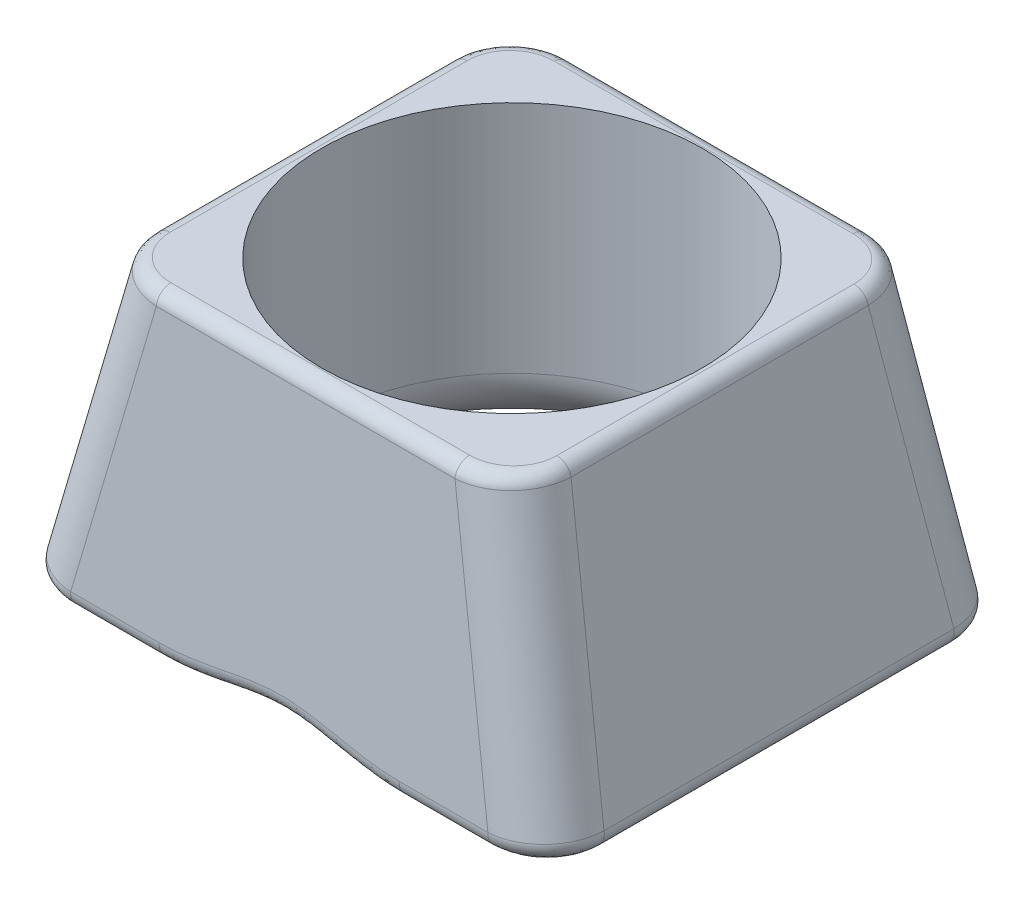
SolidWorks part; units mm, degrees
ref_plane "Front Plane" through (0, 0, 0) normal (0, 0, 1) x (1, 0, 0)
ref_plane "Top Plane" through (0, 0, 0) normal (0, 1, 0) x (1, 0, 0)
ref_plane "Right Plane" through (0, 0, 0) normal (1, 0, 0) x (0, 0, -1)
sketch "Sketch2" plane through (0, 0, 0) normal (0, 1, 0) x (1, 0, 0)
  line L1 (-58.7248, -50.8) -> (58.7502, -50.8)
  line L2 (-58.7248, -50.8) -> (-58.7248, 50.8)
  line L3 (-58.7248, 50.8) -> (58.7502, 50.8)
  line L4 (58.7502, -50.8) -> (58.7502, 50.8)
  dimension "D1" = 117.475
  dimension "D2" = 58.7248
  dimension "D3" = 101.6
  dimension "D4" = 50.8
extrude "Boss-Extrude1" add sketch "Sketch2" against normal blind 63.5
sketch "Sketch3" plane through (0, 0, 50.8) normal (0, 0, 1) x (1, 0, 0)
  line L0 (-58.7248, -63.5) -> (-44.45, 0)
  line L1 (-58.7248, 0) -> (58.7502, 0) construction
  line L2 (-58.7248, -63.5) -> (-58.7248, 0) construction
  dimension "D1" = 14.2748
extrude "Cut-Extrude1" cut sketch "Sketch3" against normal through all and the other way through all
sketch "Sketch4" plane through (0, 0, 50.8) normal (0, 0, 1) x (1, 0, 0)
  line L0 (58.7502, -63.5) -> (44.4754, 0)
  line L1 (-44.45, 0) -> (58.7502, 0) construction
  dimension "D1" = 14.2748
extrude "Cut-Extrude2" cut sketch "Sketch4" against normal through all and the other way through all flip side to cut
sketch "Sketch6" plane through (0, 0, 0) normal (1, 0, 0) x (0, 0, -1)
  line L0 (-50.8, -63.5) -> (-44.45, 0)
  line L1 (-50.8, 0) -> (50.8, 0) construction
  dimension "D1" = 6.35
extrude "Cut-Extrude3" cut sketch "Sketch6" against normal through all and the other way through all
sketch "Sketch7" plane through (0, 0, 0) normal (1, 0, 0) x (0, 0, -1)
  line L0 (50.8, -63.5) -> (44.45, 0)
  line L1 (-44.45, 0) -> (50.8, 0) construction
  dimension "D1" = 6.35
extrude "Cut-Extrude4" cut sketch "Sketch7" against normal through all and the other way through all flip side to cut
sketch "Sketch8" plane through (0, 0, 0) normal (0, 1, 0) x (1, 0, 0)
  circle A0 centre (0, 0) radius 41.275
  dimension "D1" = 82.55
extrude "Cut-Extrude5" cut sketch "Sketch8" against normal through all
fillet "Fillet1" radius 12.7 5 edges at (51.6128, -31.75, -47.625) (51.6128, -31.75, 47.625) (-51.5874, -31.75, -47.625) (-51.5874, -31.75, 47.625) (0, -63.5, 41.275)
fillet "Fillet2" radius 3.175 20 edges at (40.7627, 0, 40.8097) (44.4754, 0, 0) (40.7627, 0, -40.8097) (0.0127, 0, -44.45) (-40.7373, 0, -40.8097) (-44.45, 0, 0) (-40.7373, 0, 40.8097) (-55.0121, -63.5, 47.1597) (-58.7248, -63.5, 0) (-55.0121, -63.5, -47.1597) (32.1282, -63.5, -50.8) (-32.1155, -63.5, -50.8) (55.0375, -63.5, -47.1597) (58.7502, -63.5, 0) (55.0375, -63.5, 47.1597) (0.0127, 0, 44.45) (-32.1155, -63.5, 50.8) (32.1282, -63.5, 50.8) (11.889, -63.3696, -50.787) (-11.889, -63.3696, 50.787)
